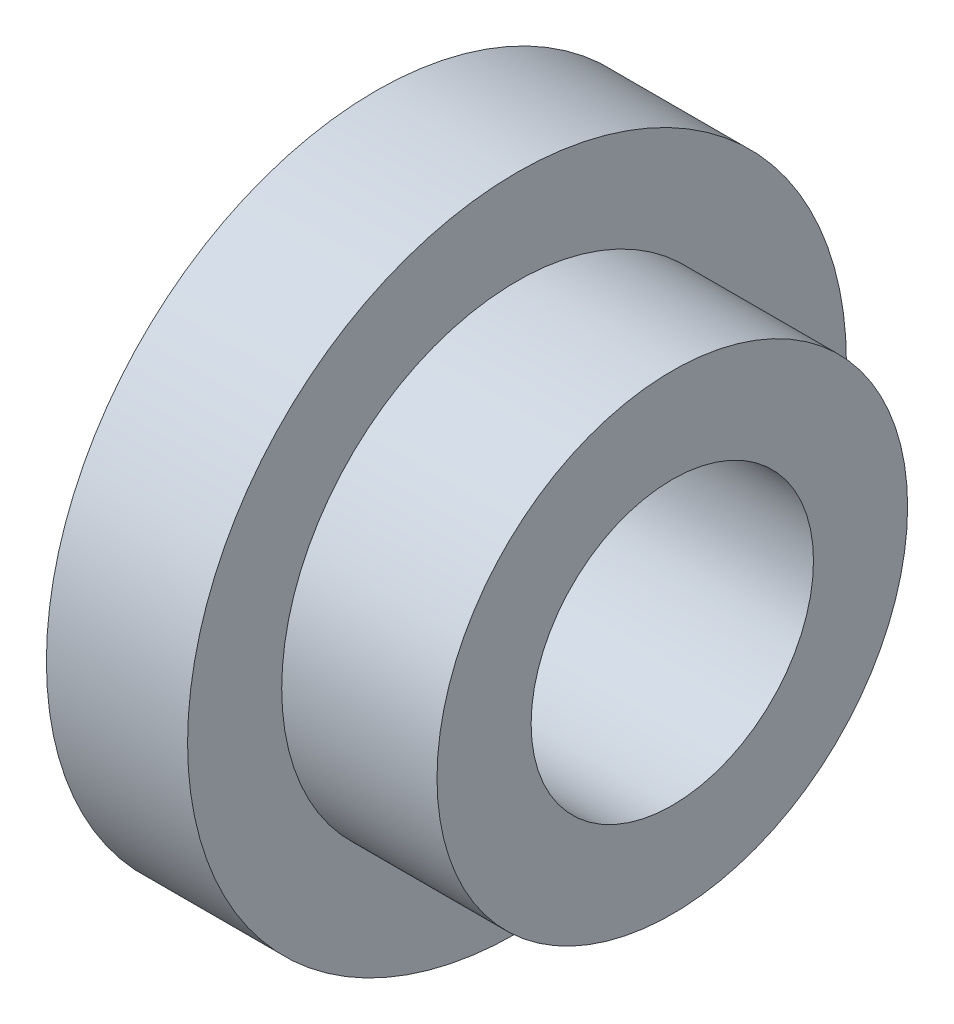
SolidWorks part; units mm, degrees
ref_plane "Front" through (0, 0, 0) normal (0, 0, 1) x (1, 0, 0)
ref_plane "Top" through (0, 0, 0) normal (0, 1, 0) x (1, 0, 0)
ref_plane "Right" through (0, 0, 0) normal (1, 0, 0) x (0, 0, -1)
sketch "Sketch1" plane through (0, 0, 0) normal (0, 1, 0) x (1, 0, 0)
  line L0 (0, 0) -> (6.3, 0)
  line L1 (6.3, 0) -> (6.3, 5)
  line L2 (6.3, 5) -> (3, 5)
  line L3 (3, 5) -> (3, 7)
  line L4 (3, 7) -> (0, 7)
  line L5 (0, 7) -> (0, 0)
revolve "Revolve1" add sketch "Sketch1" angle 360 about L0
sketch "Sketch2" plane through (6.3, 0, 0) normal (1, 0, 0) x (0, 0, -1)
  circle A0 centre (0, 0) radius 3
extrude "Cut-Extrude1" cut sketch "Sketch2" against normal through all
